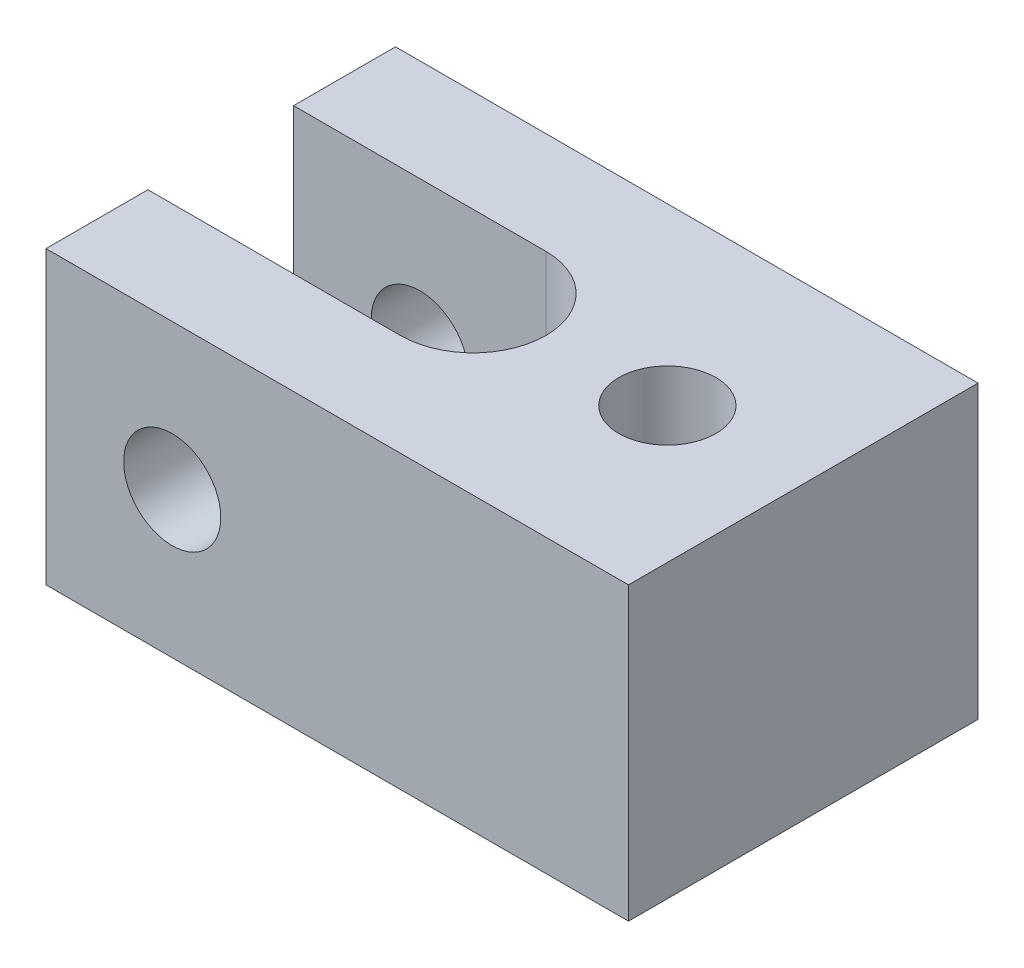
SolidWorks part; units mm, degrees
ref_plane "Front Plane" through (0, 0, 0) normal (0, 0, 1) x (1, 0, 0)
ref_plane "Top Plane" through (0, 0, 0) normal (0, 1, 0) x (1, 0, 0)
ref_plane "Right Plane" through (0, 0, 0) normal (1, 0, 0) x (0, 0, -1)
sketch "Sketch1" plane through (0, 0, 0) normal (0, 0, 1) x (1, 0, 0)
  line L0 (8.255, 9.525) -> (0, 9.525) construction
  line L1 (0, 0) -> (38.1, 0)
  line L2 (0, 0) -> (0, 19.05)
  line L3 (0, 19.05) -> (38.1, 19.05)
  line L4 (38.1, 0) -> (38.1, 19.05)
  circle A0 centre (8.255, 9.525) radius 3.175
  dimension "D1" = 6.35
  dimension "D2" = 8.255
  dimension "D3" = 19.05
  dimension "D4" = 38.1
extrude "Boss-Extrude1" add sketch "Sketch1" along normal blind 22.86
sketch "Sketch2" plane through (0, 0, 0) normal (0, -1, 0) x (1, 0, 0)
  line L0 (0, 22.86) -> (0, 0) construction
  line L1 (0, 16.1925) -> (16.51, 16.1925)
  line L2 (0, 16.1925) -> (0, 6.6675)
  line L3 (0, 6.6675) -> (16.51, 6.6675)
  line L4 (0, 22.86) -> (0, 16.1925) construction
  line L5 (0, 6.6675) -> (0, 0) construction
  arc A0 (16.51, 6.6675) -> (16.51, 16.1925) centre (16.51, 11.43) ccw
  circle A1 centre (29.21, 11.43) radius 3.175
  dimension "D3" = 6.35
  dimension "D1" = 9.525
  dimension "D2" = 16.51
  dimension "D4" = 12.7
extrude "Cut-Extrude1" cut sketch "Sketch2" against normal through all
